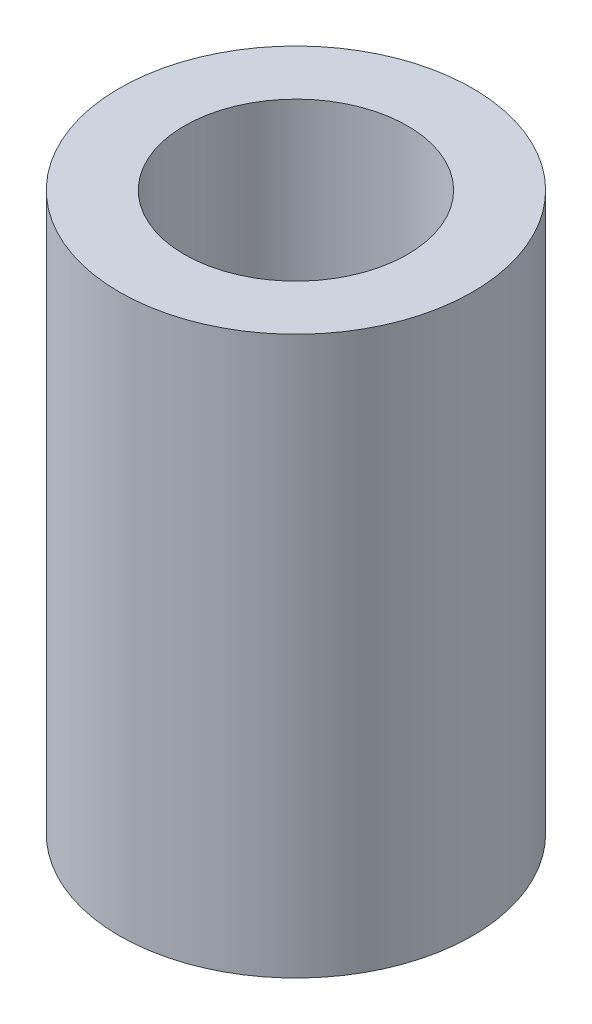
SolidWorks part; units mm, degrees
ref_plane "Plan de face" through (0, 0, 0) normal (0, 0, 1) x (1, 0, 0)
ref_plane "Plan de dessus" through (0, 0, 0) normal (0, 1, 0) x (1, 0, 0)
ref_plane "Plan de droite" through (0, 0, 0) normal (1, 0, 0) x (0, 0, -1)
sketch "Esquisse1" plane through (0, 0, 0) normal (0, 1, 0) x (1, 0, 0)
  circle A0 centre (0, 0) radius 6
  circle A1 centre (0, 0) radius 9.5
  dimension "D1" = 12
  dimension "D2" = 19
extrude "Extrusion1" add sketch "Esquisse1" along normal blind 30
